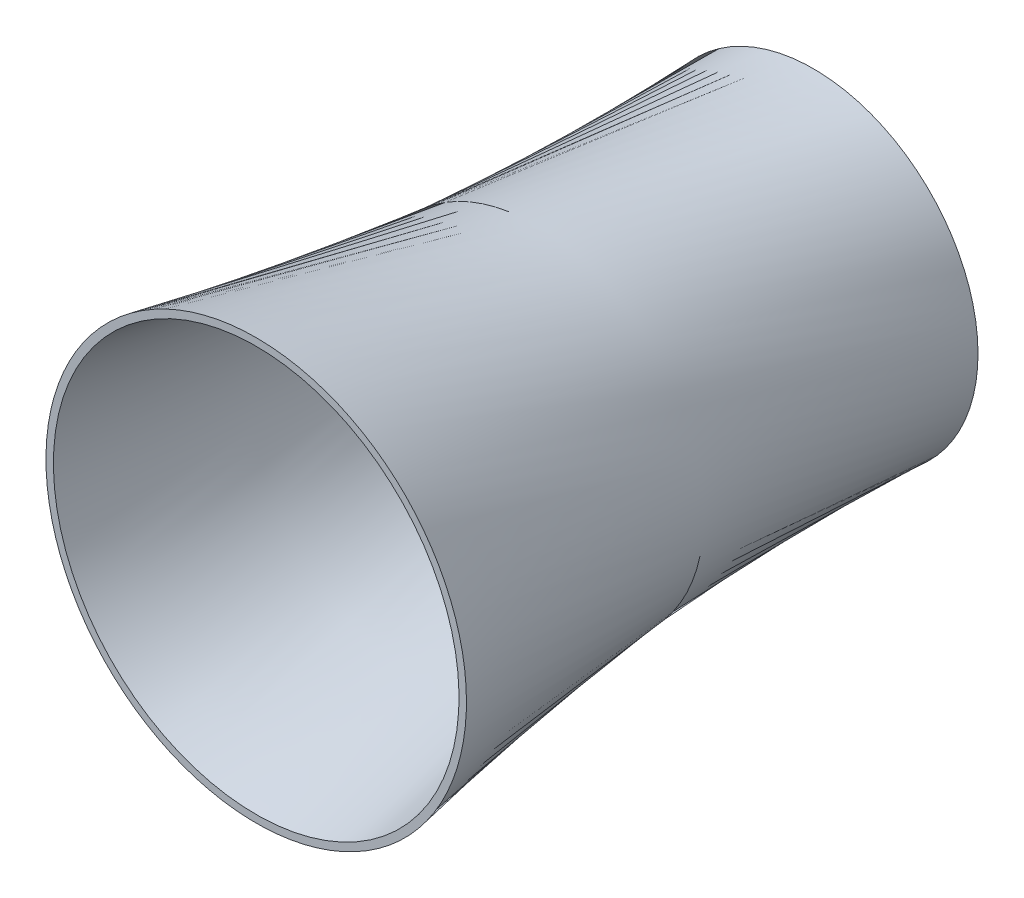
SolidWorks part; units mm, degrees
ref_plane "Front Plane" through (0, 0, 0) normal (0, 0, 1) x (1, 0, 0)
ref_plane "Top Plane" through (0, 0, 0) normal (0, 1, 0) x (1, 0, 0)
ref_plane "Right Plane" through (0, 0, 0) normal (1, 0, 0) x (0, 0, -1)
sketch "Sketch1" plane through (0, 0, 0) normal (0, 0, 1) x (1, 0, 0)
  circle A0 centre (0, 0) radius 45
  dimension "D1" = 90
ref_plane "Plane1" through (0, 0, 152.4) normal (0, 0, 1) x (1, 0, 0)
sketch "Sketch2" plane through (0, 0, 152.4) normal (0, 0, 1) x (1, 0, 0)
  circle A0 centre (0, 0) radius 57.5
  dimension "D1" = 115
loft "Loft1" add profiles "Sketch1", "Sketch2"
sketch "Sketch3" plane through (0, 0, 0) normal (0, 0, -1) x (-1, 0, 0)
  circle A0 centre (0, 0) radius 43
  circle A1 centre (0, 0) radius 45 construction
  dimension "D1" = 2
shell "Shell1" thickness 2
extrude "Cut-Extrude1" cut sketch "Sketch3" against normal up to surface (2 mm away)
ref_plane "Plane2" through (0, 0, -193) normal (0, 0, -1) x (-1, 0, 0)
